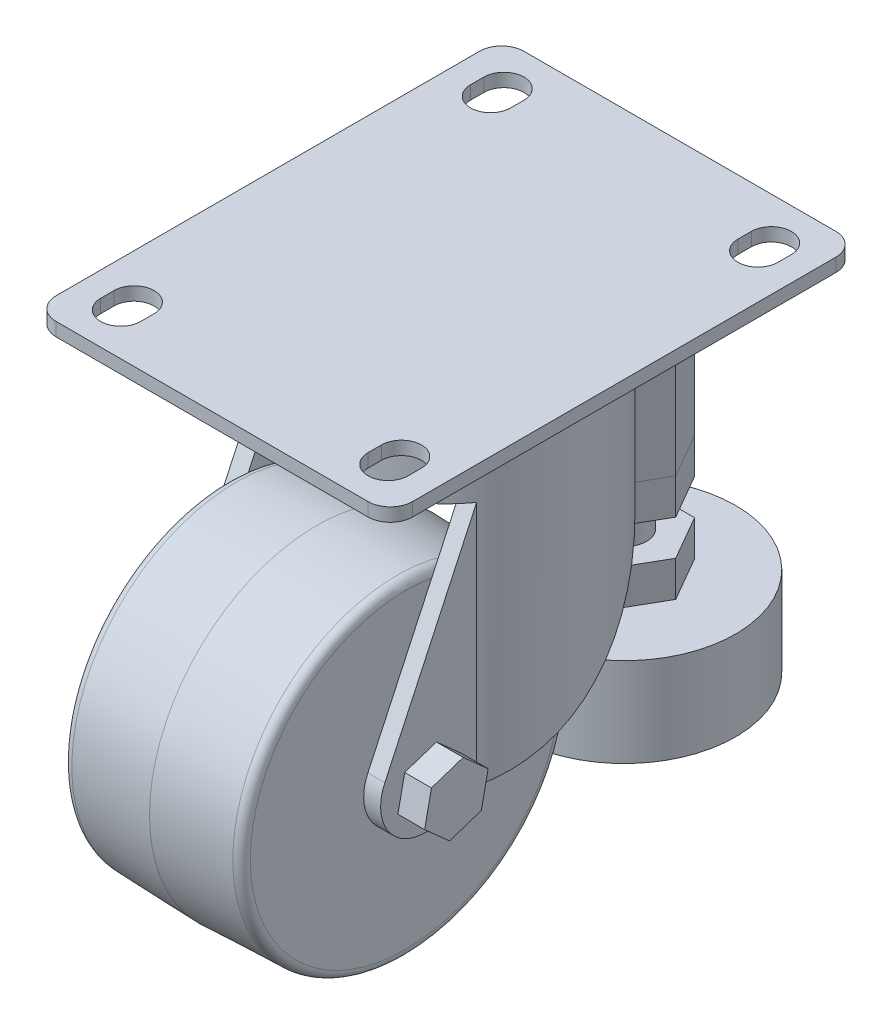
SolidWorks part; units mm, degrees
ref_plane "前视基准面" through (0, 0, 0) normal (0, 0, 1) x (1, 0, 0)
ref_plane "上视基准面" through (0, 0, 0) normal (0, 1, 0) x (1, 0, 0)
ref_plane "右视基准面" through (0, 0, 0) normal (1, 0, 0) x (0, 0, -1)
imported_body "输入1"
imported_body "输入2"
imported_body "输入3"
ref_plane "基准面1" through (0, -15, 0) normal (0, -1, 0) x (-1, 0, 0)
sketch "草图1" plane through (0, -15, 0) normal (0, -1, 0) x (-1, 0, 0)
  line L0 (0, 0) -> (0, 40) construction
  line L2 (-11.547, 40) -> (-5.7735, 30)
  line L3 (-5.7735, 30) -> (5.7735, 30)
  line L4 (5.7735, 30) -> (11.547, 40)
  line L5 (11.547, 40) -> (5.7735, 50)
  line L6 (5.7735, 50) -> (-5.7735, 50)
  line L7 (-5.7735, 50) -> (-11.547, 40)
  circle A0 centre (0, 0) radius 30 construction
  circle A1 centre (0, 0) radius 30
  circle A2 centre (0, 40) radius 10 construction
extrude "凸台-拉伸1" add sketch "草图1" along normal blind 35 separate body contours L6 L7 L2 L3 L4 L5
sketch "草图2" plane through (0, -50, 0) normal (0, -1, 0) x (1, 0, 0)
  line L6 (-5.7735, -50) -> (5.7735, -50)
  line L7 (5.7735, -50) -> (11.547, -40)
  line L8 (11.547, -40) -> (5.7735, -30)
  line L9 (5.7735, -30) -> (-5.7735, -30)
  line L10 (-5.7735, -30) -> (-11.547, -40)
  line L11 (-11.547, -40) -> (-5.7735, -50)
  line L12 (-5.7735, -50) -> (5.7735, -50)
  line L13 (5.7735, -50) -> (11.547, -40)
  line L14 (11.547, -40) -> (5.7735, -30)
  line L15 (5.7735, -30) -> (-5.7735, -30)
  line L16 (-5.7735, -30) -> (-11.547, -40)
  line L17 (-11.547, -40) -> (-5.7735, -50)
  dimension "D1" = 0
extrude "凸台-拉伸2" add sketch "草图2" along normal blind 8 separate body
sketch "草图3" plane through (0, -58, 0) normal (0, -1, 0) x (1, 0, 0)
  line L0 (0, -50) -> (0, -30) construction
  line L1 (-5.7735, -50) -> (5.7735, -50) construction
  circle A0 centre (0, -40) radius 5
  point P7 (0, 0)
extrude "凸台-拉伸3" add sketch "草图3" along normal blind 8 separate body
sketch "草图4" plane through (0, -66, 0) normal (0, -1, 0) x (1, 0, 0)
  line L6 (-11.547, -40) -> (-5.7735, -50)
  line L7 (-5.7735, -50) -> (5.7735, -50)
  line L8 (5.7735, -50) -> (11.547, -40)
  line L9 (11.547, -40) -> (5.7735, -30)
  line L10 (5.7735, -30) -> (-5.7735, -30)
  line L11 (-5.7735, -30) -> (-11.547, -40)
  line L12 (-11.547, -40) -> (-5.7735, -50)
  line L13 (-5.7735, -50) -> (5.7735, -50)
  line L14 (5.7735, -50) -> (11.547, -40)
  line L15 (11.547, -40) -> (5.7735, -30)
  line L16 (5.7735, -30) -> (-5.7735, -30)
  line L17 (-5.7735, -30) -> (-11.547, -40)
  dimension "D1" = 0
extrude "凸台-拉伸4" add sketch "草图4" along normal blind 8 separate body
sketch "草图5" plane through (0, -74, 0) normal (0, -1, 0) x (1, 0, 0)
  line L0 (0, -50) -> (0, -30) construction
  line L1 (-5.7735, -50) -> (5.7735, -50) construction
  circle A0 centre (0, -40) radius 25
extrude "凸台-拉伸5" add sketch "草图5" along normal blind 20 separate body
